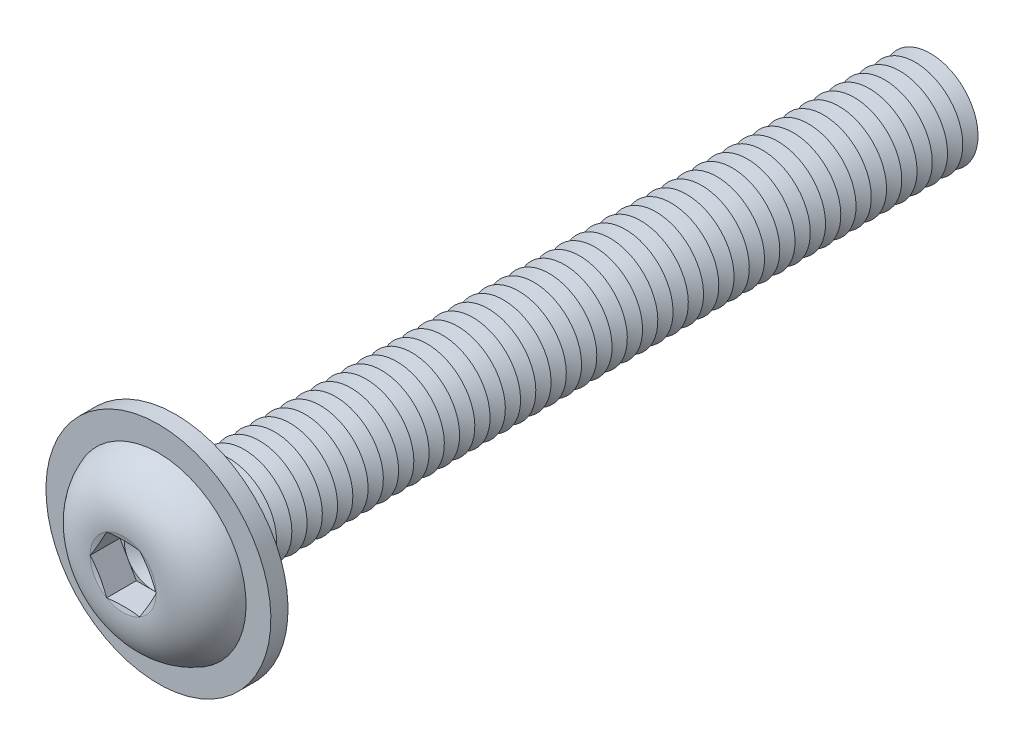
SolidWorks part; units mm, degrees
ref_plane "Front Plane" through (0, 0, 0) normal (0, 0, 1) x (1, 0, 0)
ref_plane "Top Plane" through (0, 0, 0) normal (0, 1, 0) x (1, 0, 0)
ref_plane "Right Plane" through (0, 0, 0) normal (1, 0, 0) x (0, 0, -1)
sketch "Sketch1" plane through (0, 0, 0) normal (1, 0, 0) x (0, 0, -1)
  line L0 (0, 2.5) -> (0, 4.75)
  line L3 (0, 2.5) -> (40, 2.5)
  line L4 (40, 2.5) -> (40, 0)
  line L5 (40, 0) -> (-2.75, 0) construction
  line L6 (-2.75, 0) -> (40, 0)
  line L7 (-2.75, 1.732) -> (-2.75, 0.866) construction
  line L8 (-2.75, 0.866) -> (-2.75, 0)
  line L9 (-2.75, 1.732) -> (-2.5179, 0.866)
  line L10 (-2.5179, 0.866) -> (-2.75, 0.866)
  line L11 (40, 0) -> (22.7481, 0) construction
  line L12 (0, 4.75) -> (-2.75, 4.75) construction
  arc A1 (0, 4.75) -> (-2.75, 1.732) centre (0, 1.9881) ccw
  point P8 (40, 1.25)
  dimension "D1" = 9.5
  dimension "D2" = 5
  dimension "D3" = 2.75
  dimension "D4" = 3.4641
  dimension "D5" = 40
  dimension "D6" = 15
revolve "Revolve1" add sketch "Sketch1" angle 360 about L5
fillet "Fillet1" radius 0.4 1 edges at (0, 2.5, 0)
sketch "Sketch2" plane through (0, 0, 0) normal (1, 0, 0) x (0, 0, -1)
  line L0 (39.6, 2.5) -> (40.4, 2.5)
  line L1 (40, 2.5) -> (0.4, 2.5) construction
  line L2 (40.4, 2.5) -> (40, 1.8072)
  line L3 (40, -2.5) -> (40, 2.5) construction
  line L4 (40, 1.8072) -> (39.6, 2.5)
  dimension "D1" = 0.8
revolve "Cut-Revolve1" cut sketch "Sketch2" angle 360 about axis through (0, 0, -40) along (0, 0, -1)
pattern_linear "LPattern1" count 50 spacing 0.8 along (0, 0, 1) of "Cut-Revolve1"
sketch "Sketch3" plane through (0, 0, 2.75) normal (0, 0, 1) x (1, 0, 0)
  line L7 (0.866, 1.5) -> (-0.866, 1.5)
  line L8 (-0.866, 1.5) -> (-1.7321, 0)
  line L9 (-1.7321, 0) -> (-0.866, -1.5)
  line L10 (-0.866, -1.5) -> (0.866, -1.5)
  line L11 (0.866, -1.5) -> (1.732, 0)
  line L12 (1.732, 0) -> (0.866, 1.5)
  circle A0 centre (0, 0) radius 1.5 construction
  circle A3 centre (0, 0) radius 1.7321 construction
extrude "Cut-Extrude1" cut sketch "Sketch3" against normal blind 1.56
sketch "Sketch4" plane through (0, 0, 1.19) normal (0, 0, 1) x (1, 0, 0)
  line L1 (0.866, 1.5) -> (-0.866, 1.5) construction
  circle A0 centre (0, 0) radius 1.5
extrude "Cut-Extrude2" cut sketch "Sketch4" against normal through all draft 60
sketch "Sketch5" plane through (0, 0, 0) normal (0, 0, -1) x (-1, 0, 0)
  circle A0 centre (0, 0) radius 5.9
  circle A1 centre (0, 0) radius 2.9
  circle A2 centre (0, 0) radius 2.9 construction
  dimension "D1" = 11.8
extrude "Boss-Extrude1" add sketch "Sketch5" against normal blind 0.9
